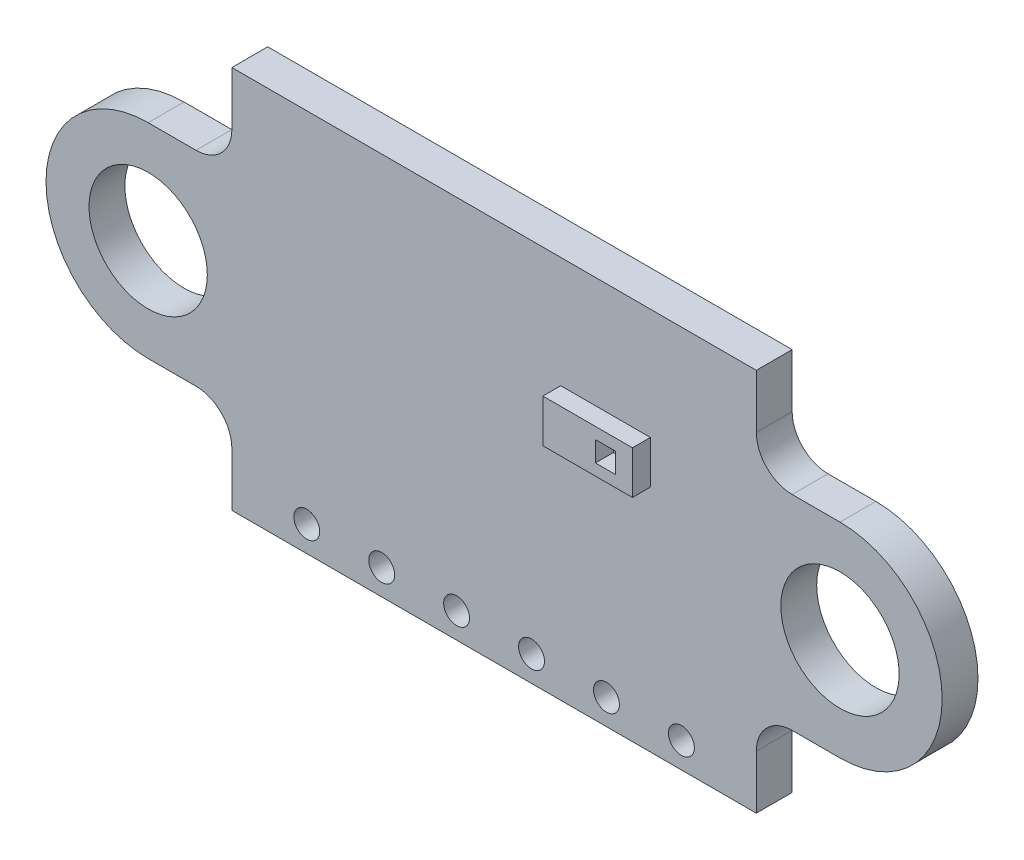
SolidWorks part; units mm, degrees
ref_plane "前视基准面" through (0, 0, 0) normal (0, 0, 1) x (1, 0, 0)
ref_plane "上视基准面" through (0, 0, 0) normal (0, 1, 0) x (1, 0, 0)
ref_plane "右视基准面" through (0, 0, 0) normal (1, 0, 0) x (0, 0, -1)
other "Configuration Table"
sketch "草图1" plane through (0, 0, 0) normal (0, 0, 1) x (1, 0, 0)
  line L0 (0, 8.9924) -> (0, -6.8553) construction
  line L1 (-7.3156, 5.35) -> (7.3156, 5.35)
  line L2 (-7.3156, 5.35) -> (-7.3156, 3.85)
  line L3 (-7.3156, -5.35) -> (7.3156, -5.35)
  line L4 (7.3156, 5.35) -> (7.3156, 3.85)
  line L5 (9.65, -2.85) -> (8.3156, -2.85)
  line L6 (9.65, 2.85) -> (8.3156, 2.85)
  line L7 (-9.65, 2.85) -> (-8.3156, 2.85)
  line L8 (-9.65, -2.85) -> (-8.3156, -2.85)
  line L9 (-7.3156, -3.85) -> (-7.3156, -5.35)
  line L10 (7.3156, -3.85) -> (7.3156, -5.35)
  line L11 (-8.4664, 0) -> (7.3156, 0) construction
  line L12 (-7.3156, -4.6378) -> (-5.2254, -4.6378) construction
  line L13 (-5.2254, -4.6378) -> (-3.1353, -4.6378) construction
  line L14 (-3.1353, -4.6378) -> (-1.0451, -4.6378) construction
  line L15 (-1.0451, -4.6378) -> (1.0451, -4.6378) construction
  line L17 (1.0451, -4.6378) -> (3.1353, -4.6378) construction
  line L18 (3.1353, -4.6378) -> (5.2254, -4.6378) construction
  line L19 (5.2254, -4.6378) -> (7.3156, -4.6378) construction
  arc A2 (-9.65, 2.85) -> (-9.65, -2.85) centre (-9.65, 0) ccw
  arc A3 (9.65, 2.85) -> (9.65, -2.85) centre (9.65, 0) cw
  arc A4 (-8.3156, 2.85) -> (-7.3156, 3.85) centre (-8.3156, 3.85) ccw
  arc A5 (8.3156, 2.85) -> (7.3156, 3.85) centre (8.3156, 3.85) cw
  arc A6 (8.3156, -2.85) -> (7.3156, -3.85) centre (8.3156, -3.85) ccw
  arc A7 (-8.3156, -2.85) -> (-7.3156, -3.85) centre (-8.3156, -3.85) cw
  circle A8 centre (-9.65, 0) radius 1.65
  circle A9 centre (9.65, 0) radius 1.65
  circle A10 centre (-5.2254, -4.6378) radius 0.3615
  circle A11 centre (-3.1353, -4.6378) radius 0.3615
  circle A12 centre (-1.0451, -4.6378) radius 0.3615
  circle A13 centre (1.0451, -4.6378) radius 0.3615
  circle A14 centre (3.1353, -4.6378) radius 0.3615
  circle A15 centre (5.2254, -4.6378) radius 0.3615
  point P0 (0, 0)
  point P18 (-12.5, 0)
  point P19 (12.5, 0)
  point P24 (-7.3156, 2.85)
  point P27 (7.3156, 2.85)
  point P30 (7.3156, -2.85)
  point P33 (-7.3156, -2.85)
  dimension "D2" = 25
  dimension "D4" = 1
  dimension "D5" = 1
  dimension "D6" = 3.3
  dimension "D1" = 19.3
  dimension "D3" = 10.7
  dimension "D7" = 14.6312
extrude "凸台-拉伸1" add sketch "草图1" along normal blind 1
sketch "草图2" plane through (0, 0, 1) normal (0, 0, 1) x (1, 0, 0)
  line L0 (7.3156, 5.35) -> (-7.3156, 5.35) construction
  line L1 (3.328, 1.932) -> (3.892, 1.932)
  line L2 (3.328, 1.932) -> (3.328, 1.368)
  line L3 (3.328, 1.368) -> (3.892, 1.368)
  line L4 (3.892, 1.932) -> (3.892, 1.368)
  line L5 (3.328, 1.932) -> (3.892, 1.368) construction
  line L6 (3.328, 1.368) -> (3.892, 1.932) construction
  line L7 (-7.3156, -5.35) -> (7.3156, -5.35) construction
  line L8 (1.86, 2.2502) -> (4.36, 2.2502)
  line L9 (1.86, 2.2502) -> (1.86, 1.0498)
  line L10 (1.86, 1.0498) -> (4.36, 1.0498)
  line L11 (4.36, 2.2502) -> (4.36, 1.0498)
  line L12 (1.86, 2.2502) -> (4.36, 1.0498) construction
  line L13 (1.86, 1.0498) -> (4.36, 2.2502) construction
  point P0 (3.61, 1.65)
  point P7 (0, 5.35)
  point P8 (3.11, 1.65)
  point P13 (0, 0)
  dimension "D1" = 3.61
  dimension "D2" = 7
  dimension "D3" = 2.5
  dimension "D4" = 0.5
extrude "凸台-拉伸2" add sketch "草图2" along normal blind 0.5
